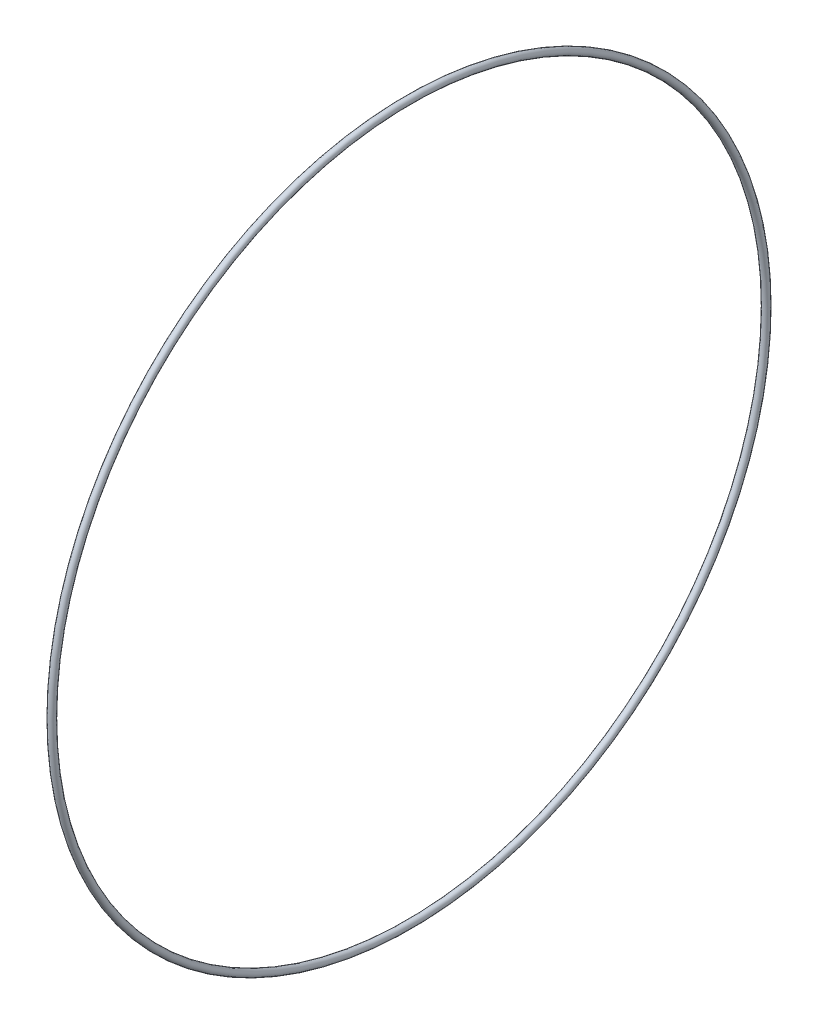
SolidWorks part; units mm, degrees
ref_plane "Plan de face" through (0, 0, 0) normal (0, 0, 1) x (1, 0, 0)
ref_plane "Plan de dessus" through (0, 0, 0) normal (0, 1, 0) x (1, 0, 0)
ref_plane "Plan de droite" through (0, 0, 0) normal (1, 0, 0) x (0, 0, -1)
sketch "Esquisse1" plane through (0, 0, 0) normal (0, 0, 1) x (1, 0, 0)
  line L0 (8, -50) -> (8, 50) construction
  line L1 (9, 52) -> (8, 52) construction
  line L2 (9, 65) -> (9, -65) construction
  line L3 (0, 0) -> (32.4612, 0) construction
  circle A0 centre (8.5, 51.5) radius 0.5
revolve "Révolution1" add sketch "Esquisse1" angle 360 about L3
